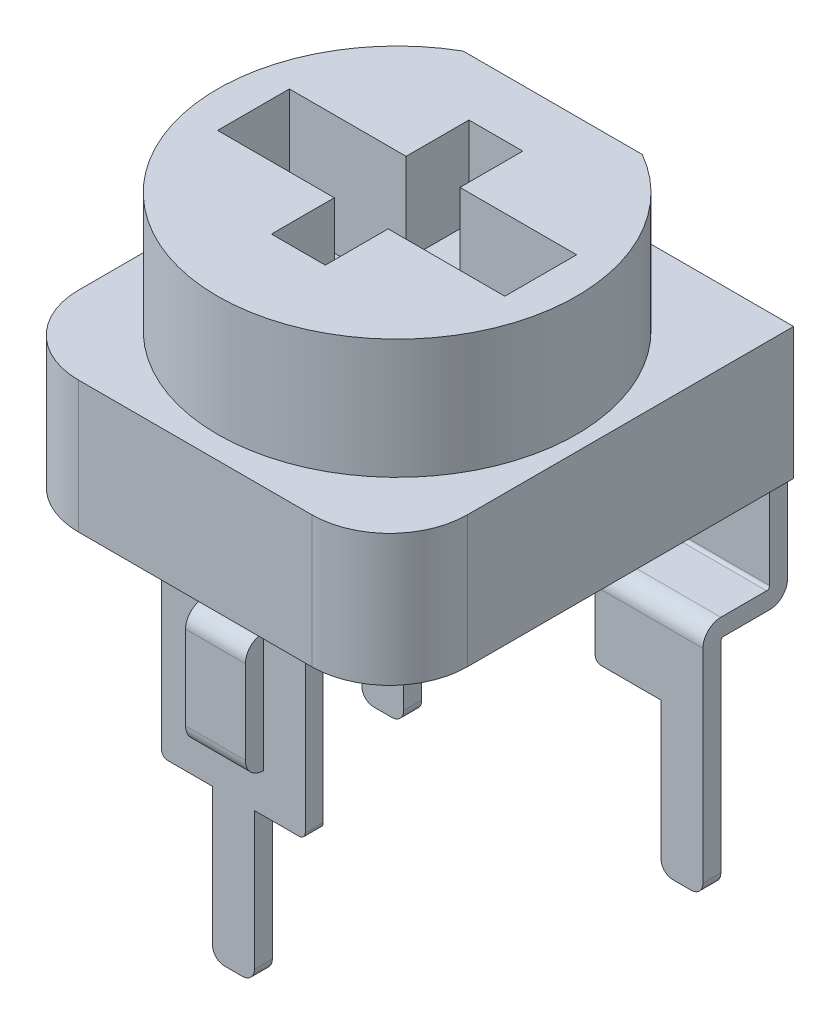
SolidWorks part; units mm, degrees
ref_plane "Front Plane" through (0, 0, 0) normal (0, 0, 1) x (1, 0, 0)
ref_plane "Top Plane" through (0, 0, 0) normal (0, 1, 0) x (1, 0, 0)
ref_plane "Right Plane" through (0, 0, 0) normal (1, 0, 0) x (0, 0, -1)
sketch "Sketch1" plane through (0, 0, 0) normal (0, 1, 0) x (1, 0, 0)
  line L0 (-1.4967, 2.6) -> (1.4967, 2.6)
  arc A0 (-1.4967, 2.6) -> (1.4967, 2.6) centre (0, 0) ccw
  dimension "D1" = 6
  dimension "D2" = 2.6
extrude "Boss-Extrude1" add sketch "Sketch1" along normal blind 2
sketch "Sketch2" plane through (0, 2, 0) normal (0, 1, 0) x (1, 0, 0)
  line L1 (-2.4, -0.6) -> (2.4, -0.6)
  line L2 (-2.4, -0.6) -> (-2.4, 0.6)
  line L3 (-2.4, 0.6) -> (2.4, 0.6)
  line L4 (2.4, -0.6) -> (2.4, 0.6)
  line L5 (-2.4, -0.6) -> (2.4, 0.6) construction
  line L6 (-2.4, 0.6) -> (2.4, -0.6) construction
  point P0 (0, 0)
  point P6 (0, 0)
  dimension "D1" = 1.2
  dimension "D2" = 4.8
extrude "Cut-Extrude1" cut sketch "Sketch2" against normal through all
sketch "Sketch3" plane through (0, 2, 0) normal (0, 1, 0) x (1, 0, 0)
  line L1 (-0.45, -1.65) -> (0.45, -1.65)
  line L2 (-0.45, -1.65) -> (-0.45, 1.65)
  line L3 (-0.45, 1.65) -> (0.45, 1.65)
  line L4 (0.45, -1.65) -> (0.45, 1.65)
  line L5 (-0.45, -1.65) -> (0.45, 1.65) construction
  line L6 (-0.45, 1.65) -> (0.45, -1.65) construction
  point P0 (0, 0)
  dimension "D1" = 0.9
  dimension "D2" = 3.3
extrude "Cut-Extrude2" cut sketch "Sketch3" against normal blind 1.5
sketch "Sketch4" plane through (0, 0, 0) normal (0, -1, 0) x (1, 0, 0)
  line L1 (-3.25, -3.375) -> (3.25, -3.375)
  line L2 (-3.25, -3.375) -> (-3.25, 2.075)
  line L3 (-1.95, 3.375) -> (1.95, 3.375)
  line L4 (3.25, -3.375) -> (3.25, 2.075)
  line L5 (-3.25, -3.375) -> (2.8764, 2.987) construction
  line L6 (-2.8764, 2.987) -> (3.25, -3.375) construction
  arc A0 (-1.95, 3.375) -> (-3.25, 2.075) centre (-1.95, 2.075) ccw
  arc A1 (3.25, 2.075) -> (1.95, 3.375) centre (1.95, 2.075) ccw
  point P0 (0, 0)
  dimension "D3" = 1.95
  dimension "D4" = 6.5
  dimension "D1" = 2.6
  dimension "D2" = 2.075
  dimension "D5" = 3.375
extrude "Boss-Extrude2" add sketch "Sketch4" along normal blind 2.2 separate body
sketch "Sketch5" plane through (0, -2.2, 0) normal (0, -1, 0) x (1, 0, 0)
  line L1 (-1.2, 2.735) -> (1.2, 2.735)
  line L2 (-1.2, 2.735) -> (-1.2, 2.435)
  line L3 (-1.2, 2.435) -> (1.2, 2.435)
  line L4 (1.2, 2.735) -> (1.2, 2.435)
  line L5 (-1.2, 2.735) -> (1.2, 2.435) construction
  line L6 (-1.2, 2.435) -> (1.2, 2.735) construction
  point P0 (0, 2.585)
  dimension "D1" = 0.3
  dimension "D2" = 2.4
  dimension "D3" = 2.585
  dimension "D4" = 1.2
extrude "Boss-Extrude3" add sketch "Sketch5" along normal blind 3.2 separate body
sketch "Sketch6" plane through (0, -5.4, 0) normal (0, -1, 0) x (1, 0, 0)
  line L1 (-0.35, 2.435) -> (0.35, 2.435)
  line L2 (-0.35, 2.435) -> (-0.35, 2.735)
  line L3 (-0.35, 2.735) -> (0.35, 2.735)
  line L4 (0.35, 2.435) -> (0.35, 2.735)
  line L5 (-0.35, 2.435) -> (0.35, 2.735) construction
  line L6 (-0.35, 2.735) -> (0.35, 2.435) construction
  line L7 (1.2, 2.435) -> (1.2, 2.735) construction
  line L8 (1.2, 2.735) -> (-1.2, 2.735) construction
  point P0 (0, 2.585)
  dimension "D1" = 0.3
  dimension "D2" = 0.7
  dimension "D3" = 1.2
  dimension "D4" = 0.15
extrude "Boss-Extrude4" add sketch "Sketch6" along normal blind 2.5
fillet "Fillet1" radius 0.1 2 edges at (-1.2, -5.4, 2.585) (1.2, -5.4, 2.585)
fillet "Fillet2" radius 0.2 2 edges at (0.35, -7.9, 2.585) (-0.35, -7.9, 2.585)
sketch "Sketch8" plane through (0, 0, 2.735) normal (0, 0, 1) x (1, 0, 0)
  line L2 (-0.5, -2.75) -> (0.5, -2.75)
  line L3 (-0.5, -2.75) -> (-0.5, -4.75)
  line L4 (-0.5, -4.75) -> (0.5, -4.75)
  line L5 (0.5, -2.75) -> (0.5, -4.75)
  line L6 (-0.5, -2.75) -> (0.5, -4.75) construction
  line L8 (0, -2.2) -> (0, -8.9171) construction
  line L9 (-1.2, -3.75) -> (1.2, -3.75) construction
  line L10 (-1.2, -5.3) -> (-1.2, -2.2) construction
  line L11 (1.2, -5.3) -> (1.2, -2.2) construction
  line L12 (-0.5, -4.75) -> (0.5, -2.75) construction
  point P0 (0, -3.75)
  dimension "D1" = 1
  dimension "D2" = 2
extrude "Boss-Extrude5" add sketch "Sketch8" along normal blind 0.3
fillet "Fillet3" radius 0.3 2 edges at (0, -4.75, 3.035) (0, -2.75, 3.035)
sketch "Sketch16" plane through (0, 0, 2.435) normal (0, 0, -1) x (-1, 0, 0)
  line L0 (-0.4, -3.05) -> (0.4, -3.05)
  line L1 (-0.4, -3.05) -> (-0.4, -4.45)
  line L2 (-0.4, -4.45) -> (0.4, -4.45)
  line L3 (0.4, -3.05) -> (0.4, -4.45)
  line L4 (-0.4, -3.05) -> (0.4, -4.45) construction
  line L5 (0, -2.2) -> (0, -5.026) construction
  line L6 (1.2, -2.2) -> (-1.2, -2.2) construction
  line L7 (-0.4, -4.45) -> (0.4, -3.05) construction
  line L8 (-1.2, -3.75) -> (1.2, -3.75) construction
  line L9 (-1.2, -5.3) -> (-1.2, -2.2) construction
  line L10 (1.2, -5.3) -> (1.2, -2.2) construction
  point P0 (0, -3.75)
  dimension "D1" = 0.8
  dimension "D2" = 1.4
extrude "Cut-Extrude5" cut sketch "Sketch16" against normal blind 0.3
fillet "Fillet18" radius 0.3 2 edges at (0, -3.05, 2.735) (0, -4.45, 2.735)
sketch "Sketch9" plane through (0, 0, -3.375) normal (0, 0, -1) x (-1, 0, 0)
  line L1 (-2.85, -1) -> (-1.05, -1)
  line L2 (-2.85, -1) -> (-2.85, -4)
  line L3 (-2.85, -4) -> (-1.05, -4)
  line L4 (-1.05, -1) -> (-1.05, -4)
  line L5 (-2.85, -1) -> (-1.05, -4) construction
  line L6 (-2.85, -4) -> (-1.05, -1) construction
  line L9 (3.25, 0) -> (-3.25, 0) construction
  line L10 (0, 0) -> (0, -9.3004) construction
  line L11 (2.85, -1) -> (1.05, -4) construction
  line L12 (2.85, -4) -> (1.05, -1) construction
  line L13 (2.85, -4) -> (1.05, -4)
  line L14 (1.05, -1) -> (1.05, -4)
  line L15 (2.85, -1) -> (1.05, -1)
  line L16 (2.85, -1) -> (2.85, -4)
  point P0 (-1.95, -2.5)
  dimension "D1" = 1.8
  dimension "D2" = 3
  dimension "D3" = 1
  dimension "D4" = 2.1
extrude "Boss-Extrude6" add sketch "Sketch9" along normal blind 0.3 separate body
fillet "Fillet4" radius 0.3 1 edges at (1.95, -1, -3.675)
fillet "Fillet5" radius 0.3 1 edges at (-1.95, -1, -3.675)
sketch "Sketch10" plane through (0, -4, 0) normal (0, -1, 0) x (1, 0, 0)
  line L1 (-2.85, -3.675) -> (-1.05, -3.675)
  line L2 (-2.85, -3.675) -> (-2.85, -2.26)
  line L3 (-2.85, -2.26) -> (-1.05, -2.26)
  line L4 (-1.05, -3.675) -> (-1.05, -2.26)
  line L5 (1.05, -3.675) -> (2.85, -3.675)
  line L6 (1.05, -3.675) -> (1.05, -2.26)
  line L7 (1.05, -2.26) -> (2.85, -2.26)
  line L8 (2.85, -3.675) -> (2.85, -2.26)
  dimension "D1" = 1.415
  dimension "D2" = 1.8
  dimension "D3" = 1.415
  dimension "D4" = 1.8
extrude "Boss-Extrude7" add sketch "Sketch10" along normal blind 0.3
fillet "Fillet6" radius 0.3 1 edges at (-1.95, -4.3, -3.675)
fillet "Fillet7" radius 0.3 1 edges at (1.95, -4.3, -3.675)
fillet "Fillet8" radius 0.05 1 edges
fillet "Fillet9" radius 0.05 1 edges
sketch "Sketch11" plane through (0, -4.3, 0) normal (0, -1, 0) x (1, 0, 0)
  line L0 (-1.05, -3.375) -> (-1.05, -2.26) construction
  line L1 (-2.85, -2.26) -> (-1.05, -2.26)
  line L2 (-2.85, -2.26) -> (-2.85, -2.56)
  line L3 (-2.85, -2.56) -> (-1.05, -2.56)
  line L4 (-1.05, -2.26) -> (-1.05, -2.56)
  line L5 (0, -1.9185) -> (0, -4.5857) construction
  line L6 (1.05, -2.26) -> (1.05, -2.56)
  line L7 (2.85, -2.56) -> (1.05, -2.56)
  line L8 (2.85, -2.26) -> (2.85, -2.56)
  line L9 (2.85, -2.26) -> (1.05, -2.26)
  dimension "D1" = 0.3
extrude "Boss-Extrude8" add sketch "Sketch11" along normal blind 1.1
fillet "Fillet10" radius 0.3 1 edges at (-1.95, -4, -2.26)
fillet "Fillet11" radius 0.3 1 edges at (1.95, -4, -2.26)
fillet "Fillet12" radius 0.05 1 edges at (1.95, -4.3, -2.56)
fillet "Fillet13" radius 0.05 1 edges at (-1.95, -4.3, -2.56)
sketch "Sketch13" plane through (2.1208, -5.4, -5.8465) normal (0, -1, 0) x (1, 0, 0)
  line L0 (0.7292, 3.2865) -> (0.7292, 3.5865) construction
  line L1 (0.0292, 3.2865) -> (0.7292, 3.2865)
  line L2 (0.0292, 3.2865) -> (0.0292, 3.5865)
  line L3 (0.0292, 3.5865) -> (0.7292, 3.5865)
  line L4 (0.7292, 3.2865) -> (0.7292, 3.5865)
  line L5 (0.0292, 3.2865) -> (0.7292, 3.5865) construction
  line L6 (0.0292, 3.5865) -> (0.7292, 3.2865) construction
  line L7 (0.7292, 3.5865) -> (-1.0708, 3.5865) construction
  point P0 (0.3792, 3.4365)
  dimension "D1" = 0.3
  dimension "D2" = 0.7
  dimension "D3" = 0.35
  dimension "D4" = 0.15
extrude "Boss-Extrude9" add sketch "Sketch13" along normal blind 2.5
fillet "Fillet14" radius 0.2 2 edges at (2.85, -7.9, -2.41) (2.15, -7.9, -2.41)
sketch "Sketch15" plane through (-2.2614, -5.4, -5.8201) normal (0, -1, 0) x (1, 0, 0)
  line L0 (1.2114, 3.5601) -> (-0.5886, 3.5601) construction
  line L1 (-0.5886, 3.2601) -> (0.1114, 3.2601)
  line L2 (-0.5886, 3.2601) -> (-0.5886, 3.5601)
  line L3 (-0.5886, 3.5601) -> (0.1114, 3.5601)
  line L4 (0.1114, 3.2601) -> (0.1114, 3.5601)
  line L5 (-0.5886, 3.2601) -> (0.1114, 3.5601) construction
  line L6 (-0.5886, 3.5601) -> (0.1114, 3.2601) construction
  line L7 (-0.5886, 3.5601) -> (-0.5886, 3.2601) construction
  point P0 (-0.2386, 3.4101)
  dimension "D1" = 0.3
  dimension "D2" = 0.7
  dimension "D3" = 0.15
  dimension "D4" = 0.35
extrude "Boss-Extrude10" add sketch "Sketch15" along normal blind 2.5
fillet "Fillet15" radius 0.2 2 edges at (-2.15, -7.9, -2.41) (-2.85, -7.9, -2.41)
fillet "Fillet16" radius 0.1 1 edges at (1.05, -5.4, -2.41)
fillet "Fillet17" radius 0.1 1 edges at (-1.05, -5.4, -2.41)
